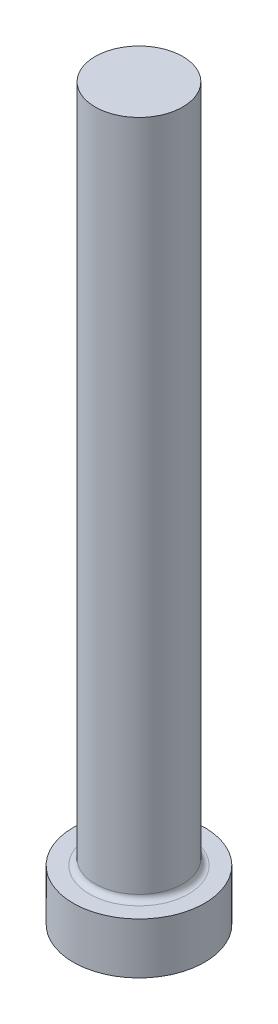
SolidWorks part; units mm, degrees
ref_plane "Plano frontal" through (0, 0, 0) normal (0, 0, 1) x (1, 0, 0)
ref_plane "Plano superior" through (0, 0, 0) normal (0, 1, 0) x (1, 0, 0)
ref_plane "Plano direito" through (0, 0, 0) normal (1, 0, 0) x (0, 0, -1)
sketch "Esboço1" plane through (0, 0, 0) normal (0, 0, 1) x (1, 0, 0)
  line L0 (0, 0) -> (9, 0)
  line L1 (9, 0) -> (9, 7)
  line L2 (9, 7) -> (6.8, 7)
  line L3 (6, 7.8) -> (6, 100)
  line L4 (6, 100) -> (0, 100)
  line L5 (0, 100) -> (0, 0) construction
  line L6 (0, 0) -> (0, 100)
  arc A0 (6.8, 7) -> (6, 7.8) centre (6.8, 7.8) cw
  dimension "D3" = 0.8
  dimension "D1" = 18
  dimension "D2" = 12
  dimension "D4" = 7
  dimension "D5" = 100
revolve "Revolução1" add sketch "Esboço1" angle 360 about L5
sketch "Esboço2"
  dimension "D1" = 1.0125
  dimension "D2" = 1.575
  dimension "D3" = 0.675
  dimension "D4" = 4.8375
wrap "Envolver1" sketch "Esboço2" source sketch "Esboço2" thickness 0.1 parameters "D1"=0.1
